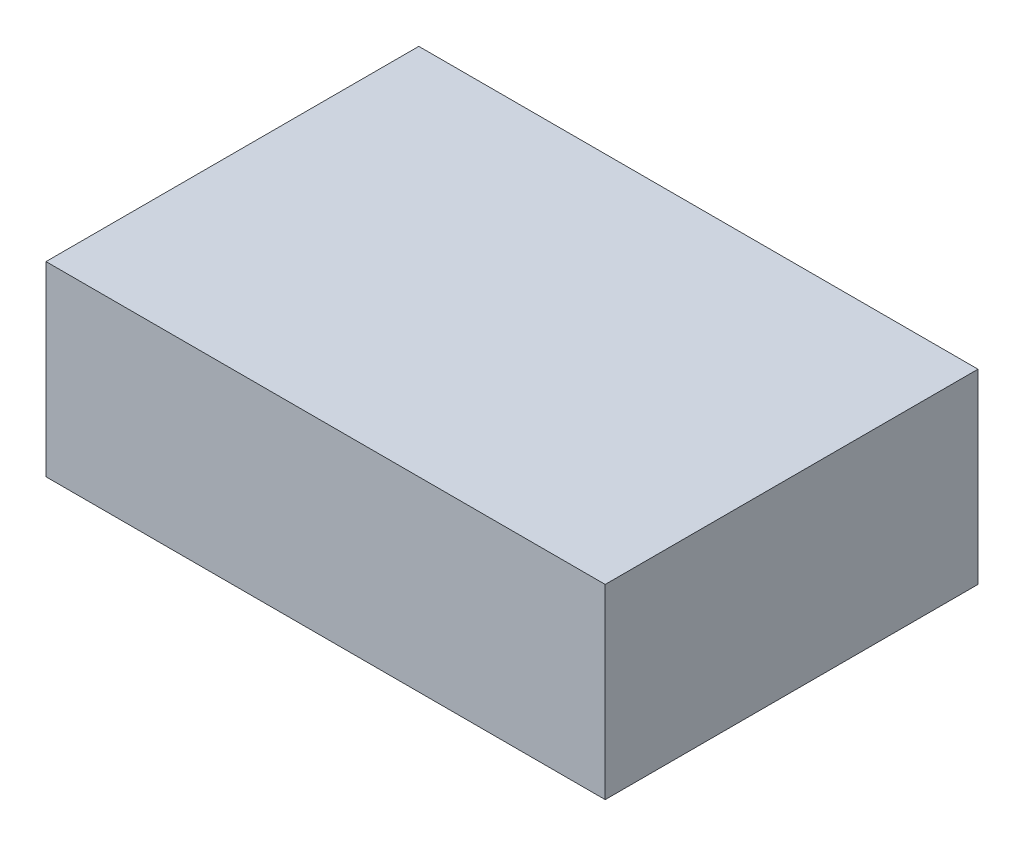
SolidWorks part; units mm, degrees
ref_plane "Vorderansicht" through (0, 0, 0) normal (0, 0, 1) x (1, 0, 0)
ref_plane "Oben" through (0, 0, 0) normal (0, 1, 0) x (1, 0, 0)
ref_plane "Rechts" through (0, 0, 0) normal (1, 0, 0) x (0, 0, -1)
sketch "Skizze1" plane through (0, 0, 0) normal (0, 0, 1) x (1, 0, 0)
  line L1 (0, 0) -> (30, 0)
  line L2 (0, 0) -> (0, 10)
  line L3 (0, 10) -> (30, 10)
  line L4 (30, 0) -> (30, 10)
  dimension "D1" = 30
  dimension "D2" = 10
extrude "Aufsatz-Linear austragen1" add sketch "Skizze1" along normal mid plane 20
